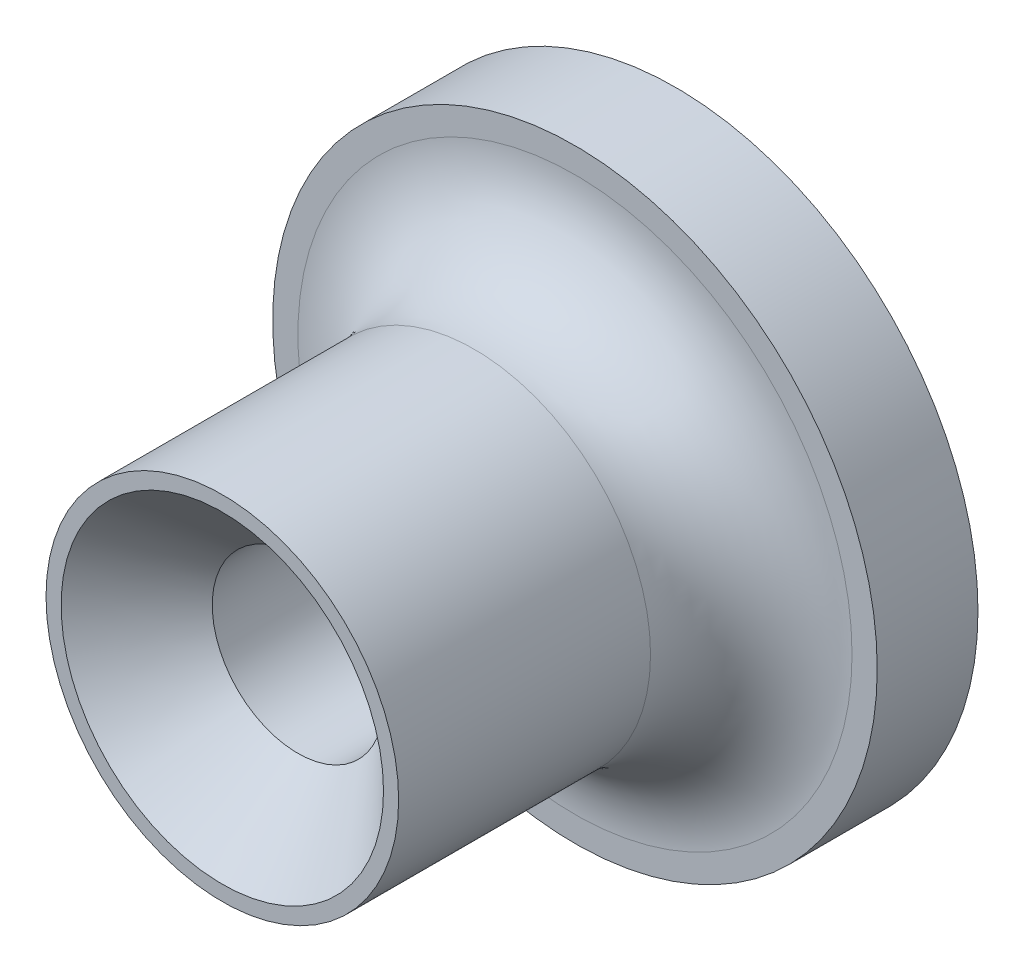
SolidWorks part; units mm, degrees
ref_plane "Front" through (0, 0, 0) normal (0, 0, 1) x (1, 0, 0)
ref_plane "Top" through (0, 0, 0) normal (0, 1, 0) x (1, 0, 0)
ref_plane "Right" through (0, 0, 0) normal (1, 0, 0) x (0, 0, -1)
sketch "Sketch1" plane through (0, 0, 0) normal (0, 0, 1) x (1, 0, 0)
  circle A0 centre (-12.795, 3.5186) radius 1.7
  circle A1 centre (-12.795, 3.5186) radius 3.5
  dimension "D1" = 3.4
  dimension "D2" = 7
extrude "Boss-Extrude1" add sketch "Sketch1" along normal blind 9
hole_wizard "CSK for M3 Flat Head Machine Screw1" positions "Sketch2" profile "Sketch3" countersink size "M3" standard "ANSI Metric"
sketch "Sketch2" plane through (0, 0, 9) normal (0, 0, 1) x (1, 0, 0)
  point P0 (-12.795, 3.5186)
sketch "Sketch3" plane through (-12.795, 3.5186, 9) normal (1, 0, 0) x (0, -1, 0)
  line L0 (0, 0) -> (0, 4.0215)
  line L1 (0, 4.0215) -> (1.7, 3)
  line L2 (1.7, 3) -> (1.7, 1.5)
  line L3 (1.7, 1.5) -> (3.2, 0)
  line L5 (3.2, 0) -> (0, 0)
  line L6 (-1.7, 1.5) -> (-3.2, 0) construction
  line L10 (0, 4.0215) -> (-1.7, 3) construction
  line L11 (0, -6.35) -> (0, 107.95) construction
  dimension "Hole Dia." = 3.4
  dimension "Hole Depth" = 3
  dimension "Near C'Sink Dia." = 6.4
  dimension "Near C'Sink Angle" = 90
  dimension "Drill Angle" = 118
sketch "Sketch4" plane through (0, 0, 0) normal (0, 0, 1) x (1, 0, 0)
  circle A0 centre (-12.795, 3.5186) radius 1.7
  circle A1 centre (-12.795, 3.5186) radius 6
  dimension "D1" = 12
  dimension "D2" = 3.4
extrude "Boss-Extrude2" add sketch "Sketch4" along normal blind 2
fillet "Fillet1" radius 2 1 edges at (-9.295, 3.5186, 2)
